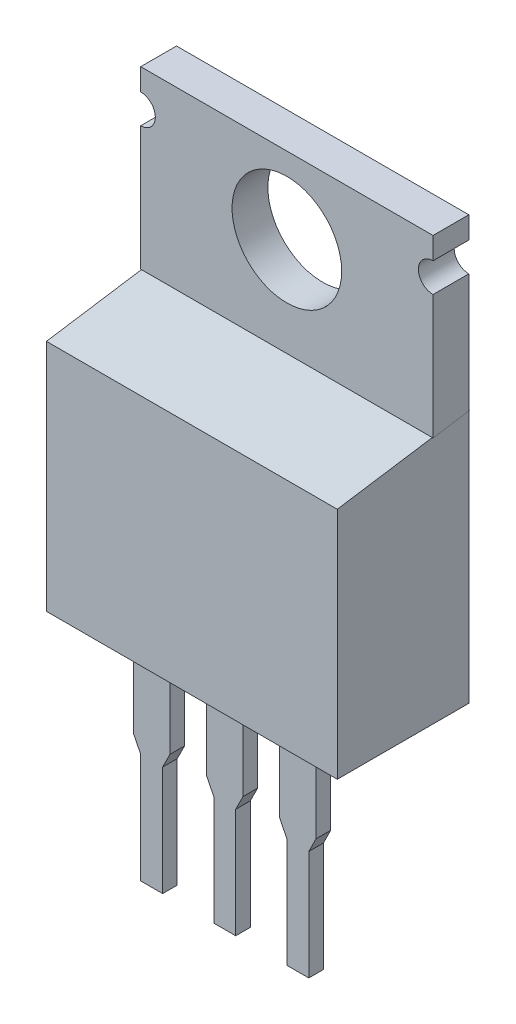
SolidWorks part; units mm, degrees
ref_plane "x/y" through (0, 0, 0) normal (0, 0, 1) x (1, 0, 0)
ref_plane "x/z" through (0, 0, 0) normal (0, 1, 0) x (1, 0, 0)
ref_plane "y/z" through (0, 0, 0) normal (1, 0, 0) x (0, 0, -1)
ref_plane "Plane2" through (0, 0, 1.397) normal (0, 0, 1) x (1, 0, 0)
ref_plane "Plane3" through (0, 3.81, 0) normal (0, 1, 0) x (-1, 0, 0)
ref_plane "Plane4" through (2.54, 0, 0) normal (1, 0, 0) x (0, 0, -1)
sketch "Sketch2" plane through (0, 3.81, 0) normal (0, 1, 0) x (-1, 0, 0)
  line L1 (2.54, -3.175) -> (-7.62, -3.175)
  line L2 (2.54, -3.175) -> (2.54, 1.397)
  line L3 (2.54, 1.397) -> (-7.62, 1.397)
  line L4 (-7.62, -3.175) -> (-7.62, 1.397)
  dimension "D1" = 10.16
  dimension "D2" = 4.572
  dimension "D3" = 7.62
  dimension "D4" = 3.175
extrude "Base-Extrude" add sketch "Sketch2" along normal blind 14.732
sketch "Sketch3" plane through (-2.54, 0, 0) normal (-1, 0, 0) x (0, 0, 1)
  line L0 (-1.905, 12.446) -> (-1.905, 18.542)
  line L1 (-1.905, 12.446) -> (1.397, 11.938)
  line L2 (-3.175, 18.542) -> (-3.175, 3.81) construction
  line L3 (-3.175, 18.542) -> (1.397, 18.542) construction
  line L5 (1.397, 18.542) -> (1.397, 3.81) construction
  dimension "D1" = 1.27
  dimension "D2" = 6.096
  dimension "D3" = 6.604
extrude "Cut-Extrude1" cut sketch "Sketch3" against normal through all and the other way through all
sketch "Sketch4" plane through (0, 0, -1.905) normal (0, 0, 1) x (1, 0, 0)
  line L0 (2.54, -50) -> (2.54, 50) construction
  line L1 (-2.54, 18.542) -> (7.62, 18.542) construction
  circle A0 centre (2.54, 15.875) radius 1.905
  dimension "D1" = 3.81
  dimension "D2" = 2.667
extrude "Cut-Extrude2" cut sketch "Sketch4" against normal blind 14.732
sketch "Sketch5" plane through (-2.54, 0, 0) normal (-1, 0, 0) x (0, 0, 1)
  line L0 (-1.905, 12.446) -> (1.397, 11.938) construction
  line L1 (-3.175, 18.542) -> (-3.175, 3.81) construction
  line L2 (-3.175, 3.81) -> (1.397, 3.81) construction
  line L3 (1.397, 11.938) -> (1.397, 3.81) construction
  line L4 (-3.175, 12.6414) -> (1.397, 11.938)
  line L5 (-3.175, 12.6414) -> (-3.175, 3.81)
  line L6 (-3.175, 3.81) -> (1.397, 3.81)
  line L7 (1.397, 11.938) -> (1.397, 3.81)
extrude "Cut-Extrude4" cut sketch "Sketch5" against normal blind 0.0254
sketch "Sketch6" plane through (7.62, 0, 0) normal (1, 0, 0) x (0, 0, -1)
  line L0 (-1.397, 11.938) -> (1.905, 12.446) construction
  line L1 (-1.397, 11.938) -> (-1.397, 3.81) construction
  line L2 (-1.397, 3.81) -> (3.175, 3.81) construction
  line L3 (3.175, 18.542) -> (3.175, 3.81) construction
  line L4 (-1.397, 11.938) -> (3.175, 12.6414)
  line L5 (-1.397, 11.938) -> (-1.397, 3.81)
  line L6 (-1.397, 3.81) -> (3.175, 3.81)
  line L7 (3.175, 12.6414) -> (3.175, 3.81)
extrude "Cut-Extrude5" cut sketch "Sketch6" against normal blind 0.0254
sketch "Sketch7" plane through (0, 0, -3.175) normal (0, 0, -1) x (-1, 0, 0)
  line L0 (-7.62, 18.542) -> (-7.62, 12.6414) construction
  line L1 (-7.62, 18.542) -> (2.54, 18.542) construction
  line L2 (2.54, 18.542) -> (2.54, 12.6414) construction
  line L3 (-7.62, 18.542) -> (-7.62, 12.6414)
  line L4 (-7.62, 18.542) -> (2.54, 18.542)
  line L5 (2.54, 18.542) -> (2.54, 12.6414)
  line L6 (-7.62, 12.6414) -> (-6.35, 12.6414)
  line L7 (-6.35, 12.6414) -> (-6.35, 7.112)
  line L8 (-6.35, 7.112) -> (1.27, 7.112)
  line L9 (1.27, 12.6414) -> (1.27, 7.112)
  line L10 (1.27, 12.6414) -> (2.54, 12.6414)
  line L11 (-7.5946, 3.81) -> (-7.5946, 12.6414) construction
  line L12 (-7.5946, 3.81) -> (2.5146, 3.81) construction
  line L13 (2.5146, 12.6414) -> (2.5146, 3.81) construction
  dimension "D1" = 1.2446
  dimension "D2" = 3.302
  dimension "D3" = 1.2446
extrude "Cut-Extrude6" cut sketch "Sketch7" against normal blind 0.0254
sketch "Sketch8" plane through (0, 0, -1.905) normal (0, 0, 1) x (1, 0, 0)
  line L0 (2.54, 15.8674) -> (2.54, 22.0486) construction
  line L1 (2.54, -50) -> (2.54, 50) construction
  line L2 (7.62, 12.446) -> (7.62, 18.542) construction
  line L3 (7.62, 16.764) -> (7.62, 17.78)
  line L4 (-2.54, 16.764) -> (-2.54, 17.78)
  line L5 (-2.54, 18.542) -> (-2.54, 12.446) construction
  line L6 (-2.54, 17.272) -> (9.7512, 17.272) construction
  line L7 (-2.54, 18.542) -> (7.62, 18.542) construction
  arc A0 (7.62, 17.78) -> (7.62, 16.764) centre (7.62, 17.272) ccw
  arc A1 (-2.54, 16.764) -> (-2.54, 17.78) centre (-2.54, 17.272) ccw
  dimension "D1" = 1.016
  dimension "D2" = 1.27
extrude "Cut-Extrude7" cut sketch "Sketch8" against normal blind 2.54
sketch "Sketch9" plane through (0, 0, 0) normal (0, 0, 1) x (1, 0, 0)
  line L0 (0, 3.81) -> (0, -3.81)
  line L1 (50, 3.81) -> (-50, 3.81) construction
  dimension "D1" = 7.62
extrude "Boss-Extrude-Thin1" add sketch "Sketch9" along normal mid plane 0.508 thin
ref_plane "Plane5" through (0.635, -3.81, 0.254) normal (0, -1, 0) x (1, 0, 0)
sketch "Sketch11" plane through (0, 0, 0.254) normal (0, 0, 1) x (1, 0, 0)
  line L0 (0.635, 0.508) -> (0.635, -3.81)
  line L1 (0.635, 3.81) -> (0.635, -3.81) construction
  line L2 (-0.635, 0.508) -> (-0.635, -3.81)
  line L3 (-0.635, 3.81) -> (-0.635, -3.81) construction
  line L4 (-0.381, 0) -> (-0.381, -3.81)
  line L5 (0.381, 0) -> (0.381, -3.81)
  line L6 (-49.365, -3.81) -> (50.635, -3.81) construction
  line L7 (-0.635, -3.81) -> (-0.381, -3.81)
  line L8 (0.381, -3.81) -> (0.635, -3.81)
  line L9 (0.381, 0) -> (0.635, 0.508)
  line L10 (-0.381, 0) -> (-0.635, 0.508)
  dimension "D1" = 0.762
  dimension "D2" = 0.254
  dimension "D3" = 4.318
extrude "Cut-Extrude8" cut sketch "Sketch11" against normal blind 1.27
pattern_linear "LPattern1" count 3 spacing 2.54 along (1, 0, 0) of "Boss-Extrude-Thin1", "Cut-Extrude8"
sketch "Mounting_Plane" plane through (0, 0, 0) normal (0, 1, 0) x (1, 0, 0)
  circle A0 centre (0, 0) radius 0.4572
  circle A1 centre (2.54, 0) radius 0.4572
  circle A2 centre (5.08, 0) radius 0.4572
